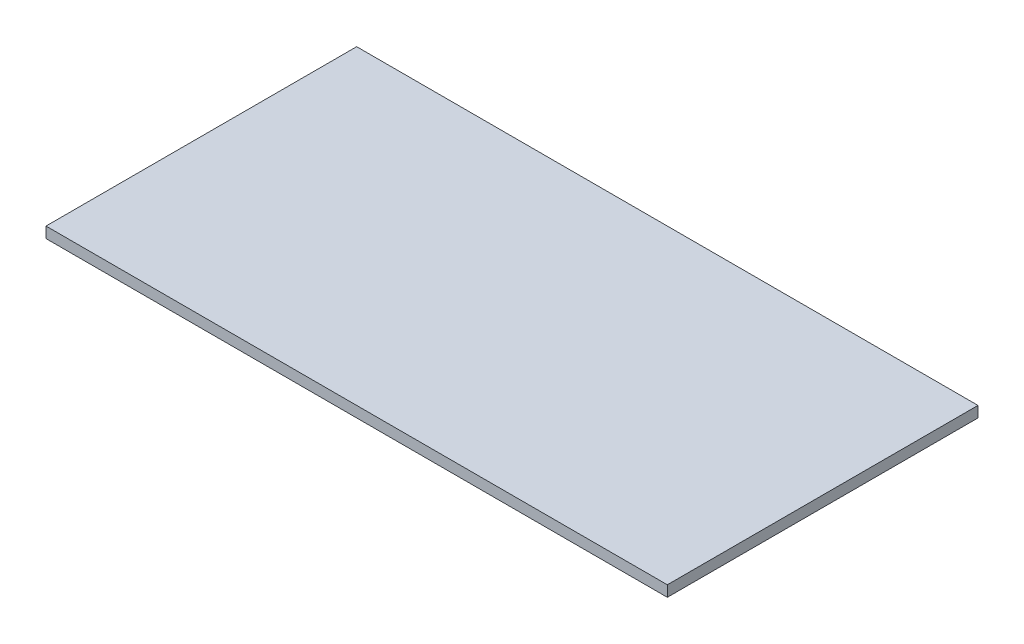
SolidWorks part; units mm, degrees
ref_plane "Plan de face" through (0, 0, 0) normal (0, 0, 1) x (1, 0, 0)
ref_plane "Plan de dessus" through (0, 0, 0) normal (0, 1, 0) x (1, 0, 0)
ref_plane "Plan de droite" through (0, 0, 0) normal (1, 0, 0) x (0, 0, -1)
sketch "Esquisse1" plane through (0, 0, 0) normal (0, 1, 0) x (1, 0, 0)
  line L0 (-55, 0) -> (55, 0) construction
  line L1 (-800, 400) -> (800, 400)
  line L2 (-800, 400) -> (-800, -400)
  line L3 (-800, -400) -> (800, -400)
  line L4 (800, 400) -> (800, -400)
  line L5 (0, -55) -> (0, 55) construction
  point P4 (-800, 0)
  point P7 (0, 400)
  dimension "D1" = 1600
  dimension "D2" = 800
extrude "Boss.-Extru.1" add sketch "Esquisse1" along normal blind 28
hole_wizard "Fraisage pour vis à tête fraisée M81" positions "Esquisse3" profile "Esquisse4" countersink size "M8" standard "DIN"
sketch "Esquisse3" plane through (0, 0, 0) normal (0, -1, 0) x (-1, 0, 0)
  point P0 (750, -350)
  point P3 (750, -50)
  point P6 (650, -350)
  point P9 (650, -50)
  point P12 (650, 50)
  point P15 (650, 350)
  point P18 (750, 50)
  point P21 (750, 350)
  point P24 (-750, -350)
  point P27 (-750, -50)
  point P30 (-650, -50)
  point P33 (-650, -350)
  point P36 (-750, 50)
  point P39 (-750, 350)
  point P42 (-650, 350)
  point P45 (-650, 50)
  dimension "D1" = 650
  dimension "D2" = 100
  dimension "D3" = 650
  dimension "D4" = 100
  dimension "D5" = 50
  dimension "D6" = 300
  dimension "D7" = 50
  dimension "D8" = 300
sketch "Esquisse4" plane through (-750, 0, 350) normal (1, 0, 0) x (0, 0, -1)
  line L0 (0, 0) -> (0, 22.4034)
  line L1 (0, 22.4034) -> (4, 20)
  line L2 (4, 20) -> (4, 2.5)
  line L3 (4, 2.5) -> (6.5, 0)
  line L5 (6.5, 0) -> (0, 0)
  line L6 (-4, 2.5) -> (-6.5, 0) construction
  line L10 (0, 22.4034) -> (-4, 20) construction
  line L11 (0, -6.35) -> (0, 107.95) construction
  dimension "Diamètre du perçage" = 8
  dimension "Profondeur du perçage" = 20
  dimension "Diamètre du fraisage entrant" = 13
  dimension "Angle du fraisage entrant" = 90
  dimension "Angle de pointe" = 118
